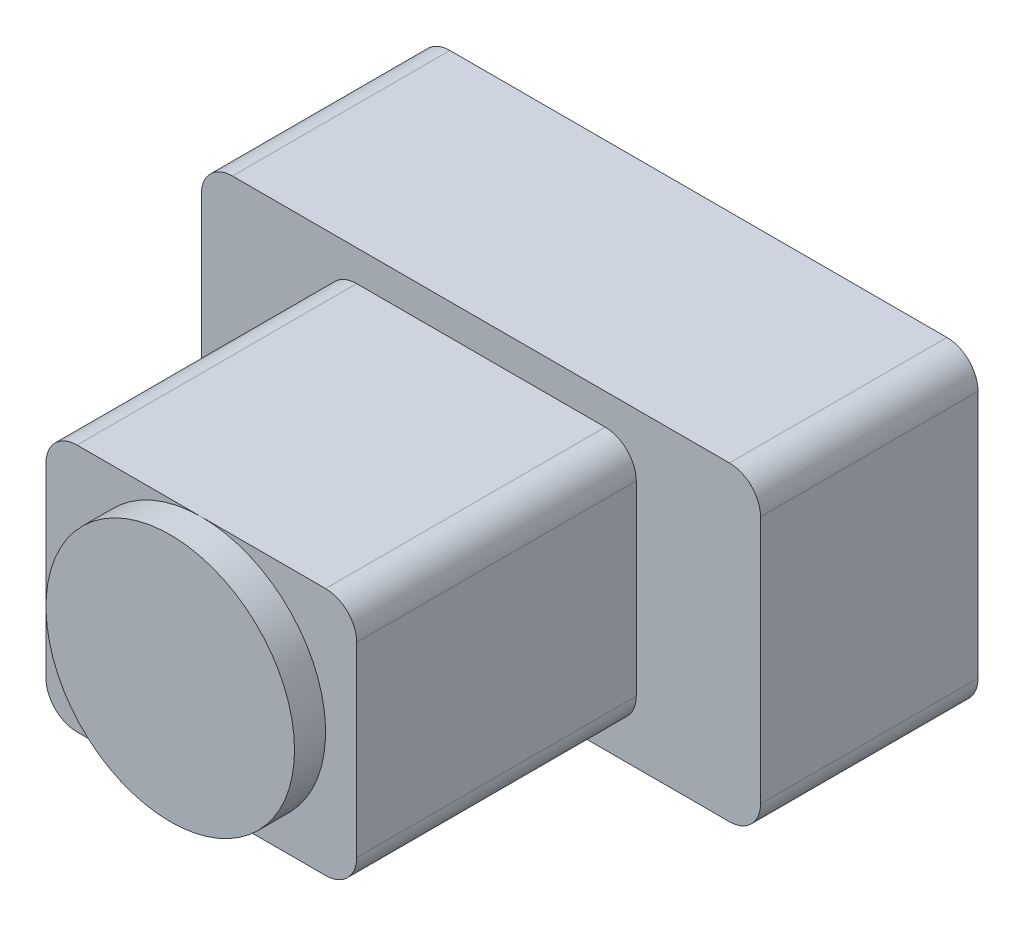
SolidWorks part; units mm, degrees
ref_plane "Alzado" through (0, 0, 0) normal (0, 0, 1) x (1, 0, 0)
ref_plane "Planta" through (0, 0, 0) normal (0, 1, 0) x (1, 0, 0)
ref_plane "Vista lateral" through (0, 0, 0) normal (1, 0, 0) x (0, 0, -1)
sketch "Croquis1" plane through (0, 0, 0) normal (0, 0, 1) x (1, 0, 0)
  line L0 (0, -55) -> (0, 55) construction
  line L1 (-40, 25) -> (40, 25)
  line L2 (-45, 20) -> (-45, -20)
  line L3 (-40, -25) -> (40, -25)
  line L4 (45, 20) -> (45, -20)
  line L5 (55, 0) -> (-55, 0) construction
  arc A0 (40, 25) -> (45, 20) centre (40, 20) cw
  arc A1 (40, -25) -> (45, -20) centre (40, -20) ccw
  arc A2 (-45, -20) -> (-40, -25) centre (-40, -20) ccw
  arc A3 (-40, 25) -> (-45, 20) centre (-40, 20) ccw
  point P10 (45, 25)
  point P17 (-45, 25)
  dimension "D5" = 5
  dimension "D1" = 90
  dimension "D2" = 45
  dimension "D3" = 50
  dimension "D4" = 25
extrude "Saliente-Extruir1" add sketch "Croquis1" along normal blind 35
sketch "Croquis2" plane through (0, 0, 35) normal (0, 0, 1) x (1, 0, 0)
  line L0 (0, -55) -> (0, 55) construction
  line L1 (-20, 20) -> (20, 20)
  line L2 (-25, 15) -> (-25, -15)
  line L3 (-20, -20) -> (20, -20)
  line L4 (25, 15) -> (25, -15)
  line L6 (-40, -25) -> (40, -25) construction
  arc A0 (-25, -15) -> (-20, -20) centre (-20, -15) ccw
  arc A1 (20, -20) -> (25, -15) centre (20, -15) ccw
  arc A2 (20, 20) -> (25, 15) centre (20, 15) cw
  arc A3 (-20, 20) -> (-25, 15) centre (-20, 15) ccw
  point P14 (25, 20)
  point P17 (-25, 20)
  dimension "D5" = 5
  dimension "D1" = 50
  dimension "D2" = 25
  dimension "D3" = 40
  dimension "D4" = 5
extrude "Saliente-Extruir2" add sketch "Croquis2" along normal blind 45
sketch "Croquis4" plane through (0, 0, 80) normal (0, 0, 1) x (1, 0, 0)
  circle A0 centre (0, 0) radius 20
extrude "Saliente-Extruir3" add sketch "Croquis4" along normal blind 5
